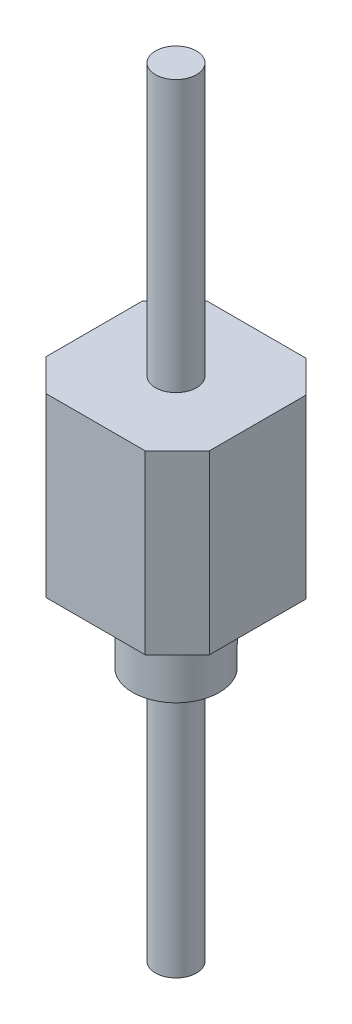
SolidWorks part; units mm, degrees
ref_plane "Plan de face" through (0, 0, 0) normal (0, 0, 1) x (1, 0, 0)
ref_plane "Plan de dessus" through (0, 0, 0) normal (0, 1, 0) x (1, 0, 0)
ref_plane "Plan de droite" through (0, 0, 0) normal (1, 0, 0) x (0, 0, -1)
sketch "Esquisse1" plane through (0, 0, 0) normal (0, 1, 0) x (1, 0, 0)
  line L0 (0, -7.9509) -> (0, 2.8008) construction
  line L1 (-2.171, 1.25) -> (5.4216, 1.25) construction
  line L2 (-2.171, -1.25) -> (5.4216, -1.25) construction
  line L3 (-9.575, 0) -> (3.9061, 0) construction
  line L4 (-1.27, -2.1606) -> (-1.27, 3.9067) construction
  line L5 (1.27, -2.1606) -> (1.27, 3.9067) construction
  line L6 (-0.77, 1.7646) -> (-0.77, 0.891) construction
  line L7 (-2.171, 0.75) -> (-0.5875, 0.75) construction
  line L8 (-1.27, 0.75) -> (-0.77, 1.25)
  line L9 (1.27, 0.75) -> (0.77, 1.25)
  line L10 (1.27, -0.75) -> (0.77, -1.25)
  line L11 (-1.27, -0.75) -> (-0.77, -1.25)
  line L12 (-1.27, 0.75) -> (-1.27, -0.75)
  line L13 (-0.77, -1.25) -> (0.77, -1.25)
  line L14 (1.27, -0.75) -> (1.27, 0.75)
  line L15 (-0.77, 1.25) -> (0.77, 1.25)
  dimension "D1" = 2.5
  dimension "D2" = 1.25
  dimension "D3" = 2.54
  dimension "D4" = 1.27
  dimension "D5" = 0.5
  dimension "D6" = 0.5
extrude "Boss.-Extru.1" add sketch "Esquisse1" along normal blind 2.75
sketch "Esquisse2" plane through (0, 2.75, 0) normal (0, 1, 0) x (1, 0, 0)
  circle A0 centre (0, 0) radius 0.32
extrude "Boss.-Extru.2" add sketch "Esquisse2" along normal blind 4.22
sketch "Esquisse3" plane through (0, 0, 0) normal (0, -1, 0) x (1, 0, 0)
  circle A0 centre (0, 0) radius 0.675
extrude "Boss.-Extru.3" add sketch "Esquisse3" along normal blind 1.18
sketch "Esquisse4" plane through (0, -1.18, 0) normal (0, -1, 0) x (1, 0, 0)
  circle A0 centre (0, 0) radius 0.32
extrude "Boss.-Extru.4" add sketch "Esquisse4" along normal blind 3.96
